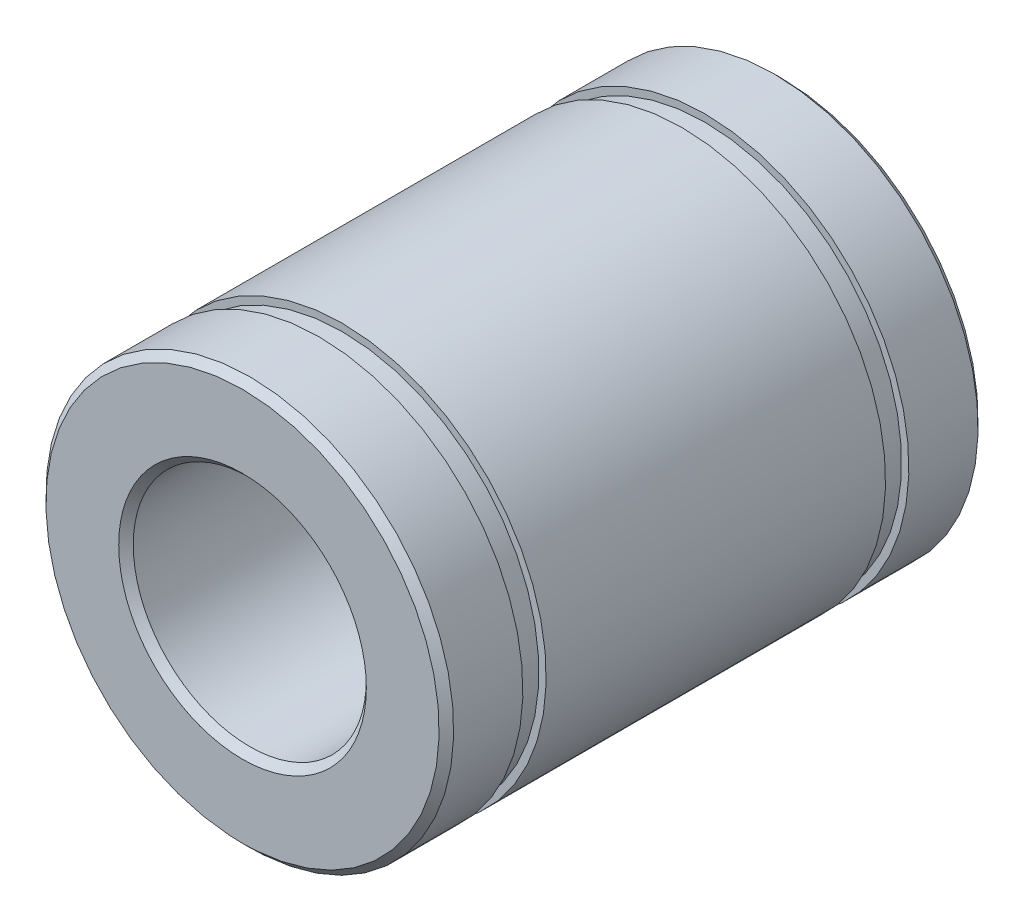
SolidWorks part; units mm, degrees
other "Solid1"
ref_plane "Front Plane" through (0, 0, 0) normal (0, 0, 1) x (1, 0, 0)
ref_plane "Top Plane" through (0, 0, 0) normal (0, 1, 0) x (1, 0, 0)
ref_plane "Right Plane" through (0, 0, 0) normal (1, 0, 0) x (0, 0, -1)
imported_body "2.7009 LM16UU.stp<1>"
move or copy body "Body-Move/Copy1" bodies to move or copy 101 copy no rotation origin (0, 18.5, 0) rotation axis (1, 0, 0) rotation angle 90
